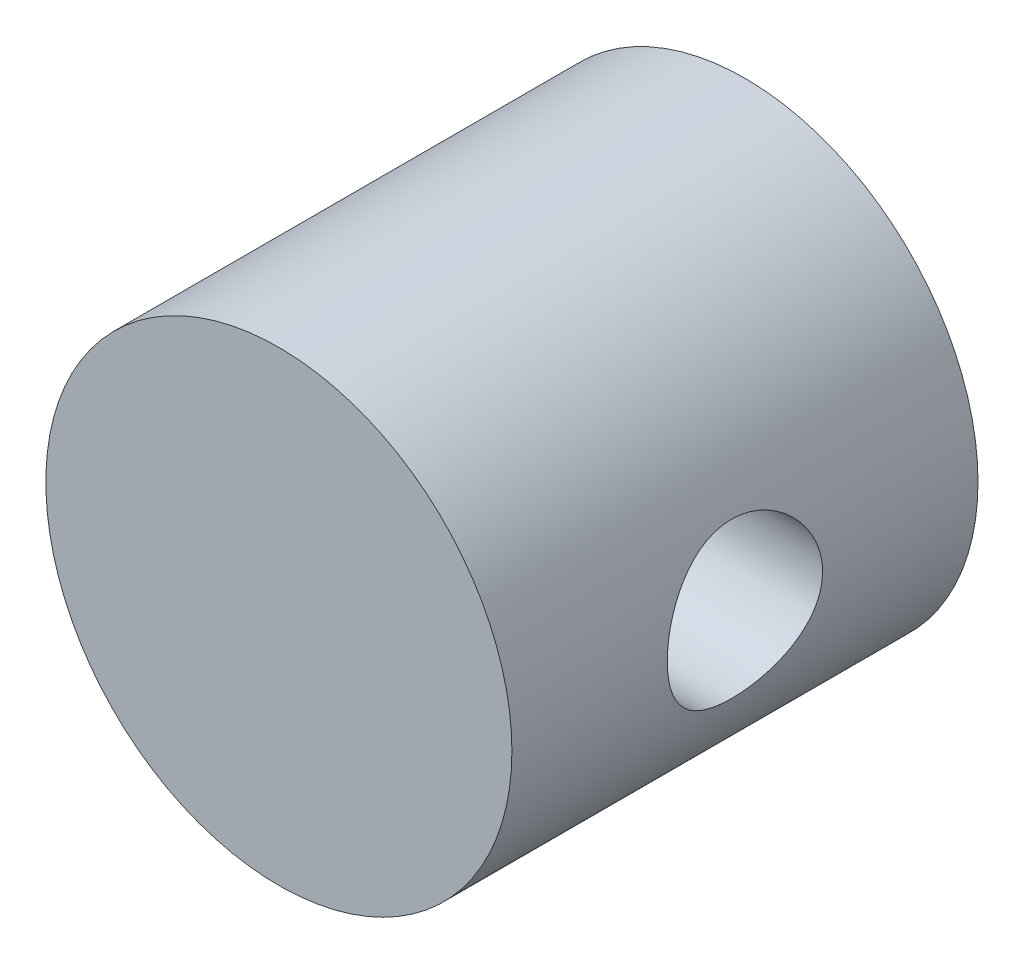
SolidWorks part; units mm, degrees
ref_plane "Plan de face" through (0, 0, 0) normal (0, 0, 1) x (1, 0, 0)
ref_plane "Plan de dessus" through (0, 0, 0) normal (0, 1, 0) x (1, 0, 0)
ref_plane "Plan de droite" through (0, 0, 0) normal (1, 0, 0) x (0, 0, -1)
sketch "Esquisse1" plane through (0, 0, 0) normal (0, 0, 1) x (1, 0, 0)
  circle A0 centre (0, 0) radius 7.5
  dimension "D1" = 15
extrude "Extrusion1" add sketch "Esquisse1" along normal blind 15
ref_plane "Plan1" through (7.5, 0, 0) normal (1, 0, 0) x (0, 0, -1)
hole_wizard "Trou taraudé M6x1.01" positions "Esquisse4" profile "Esquisse3" tap size "M6x1.0" standard "ISO"
sketch "Esquisse4" plane through (7.5, 0, 0) normal (1, 0, 0) x (0, 0, -1)
  line L0 (-15, 7.5) -> (-15, -7.5) construction
  line L2 (0, 7.5) -> (-15, 7.5) construction
  point P0 (-7.5, 0)
  dimension "D1" = 7.5
  dimension "D2" = 7.5
sketch "Esquisse3" plane through (7.5, 0, 7.5) normal (0, 1, 0) x (0, 0, -1)
  line L0 (0, 0) -> (0, 16.5022)
  line L1 (0, 16.5022) -> (2.5, 15)
  line L2 (2.5, 15) -> (2.5, 0)
  line L5 (2.5, 0) -> (0, 0)
  line L10 (0, 16.5022) -> (-2.5, 15) construction
  line L11 (0, -6.35) -> (0, 107.95) construction
  dimension "Diamètre du trou pour taraudage" = 5
  dimension "Profondeur du trou pour taraudage" = 15
  dimension "Angle de pointe" = 118
